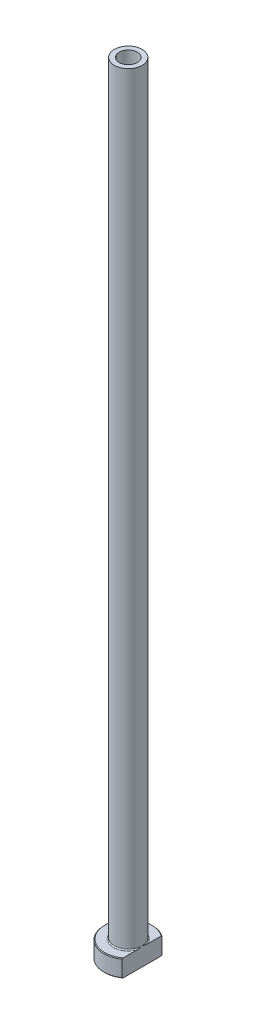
SolidWorks part; units mm, degrees
ref_plane "Front Plane" through (0, 0, 0) normal (0, 0, 1) x (1, 0, 0)
ref_plane "Top Plane" through (0, 0, 0) normal (0, 1, 0) x (1, 0, 0)
ref_plane "Right Plane" through (0, 0, 0) normal (1, 0, 0) x (0, 0, -1)
sketch "Sketch1" plane through (0, 0, 0) normal (0, 0, 1) x (1, 0, 0)
  line L0 (-2.6, 225) -> (-4, 225)
  line L1 (-4, 225) -> (-4, 5)
  line L2 (-4, 5) -> (-7, 5)
  line L3 (-7, 5) -> (-7, 0)
  line L4 (6.05, 0) -> (-6.05, 0) construction
  line L5 (-7, 0) -> (-2.85, 0)
  line L6 (-2.6, 180) -> (-2.6, 225)
  line L7 (0, 92.1877) -> (0, -15.5353) construction
  line L8 (0, -7.7) -> (0, 7.7) construction
  line L9 (-2.6, 180) -> (-2.85, 168)
  line L10 (-2.85, 168) -> (-2.85, 0)
  dimension "D1" = 0.25
  dimension "ID" = 5.2
  dimension "OD" = 8
  dimension "L" = 225
  dimension "H" = 14
  dimension "T" = 5
  dimension "N" = 45
  dimension "D2" = 12
  dimension "L-N" = 180
revolve "Revolve1" add sketch "Sketch1" angle 360 about L7
fillet "Fillet1" radius 0.3 1 edges at (0, 5, 4)
chamfer "Chamfer1" distance 0.2 angle 45 2 edges at (0, 5, 7) (0, 0, 7)
sketch "Sketch2" plane through (0, 0, 0) normal (0, -1, 0) x (1, 0, 0)
  line L0 (4, 5.7446) -> (4, -5.7446)
  circle A0 centre (0, 0) radius 7 construction
  arc A1 (4, 5.7446) -> (4, -5.7446) centre (0, 0) cw
  circle A2 centre (0, 0) radius 4 construction
extrude "Cut-Extrude1" cut sketch "Sketch2" against normal through all
chamfer "Chamfer2" distance 0.5 angle 45 1 edges at (0, 0, 2.85)
